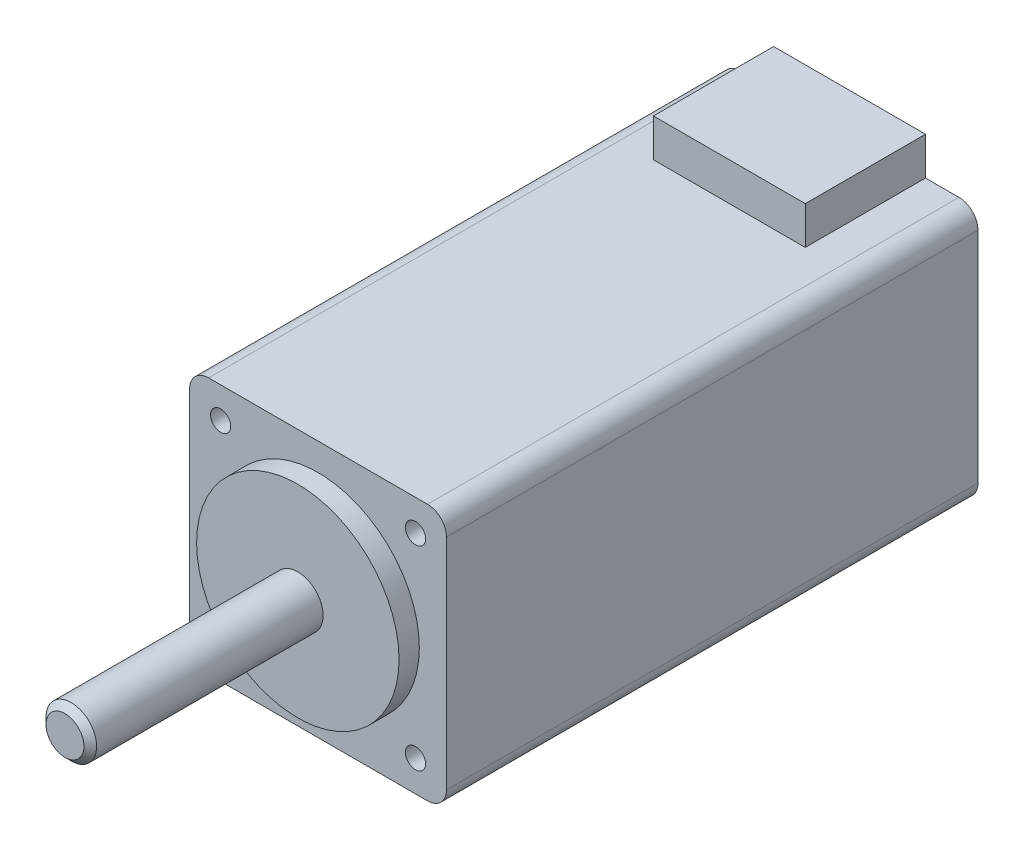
SolidWorks part; units mm, degrees
ref_plane "前视基准面" through (0, 0, 0) normal (0, 0, 1) x (1, 0, 0)
ref_plane "上视基准面" through (0, 0, 0) normal (0, 1, 0) x (1, 0, 0)
ref_plane "右视基准面" through (0, 0, 0) normal (1, 0, 0) x (0, 0, -1)
sketch "草图1" plane through (0, 0, 0) normal (0, 0, 1) x (1, 0, 0)
  circle A0 centre (0, 0) radius 8
extrude "凸台-拉伸1" add sketch "草图1" against normal blind 1.6
sketch "草图2" plane through (0, 0, 0) normal (0, 0, 1) x (1, 0, 0)
  circle A0 centre (0, 0) radius 2
extrude "凸台-拉伸2" add sketch "草图2" along normal blind 18.4
chamfer "倒角1" distance 0.5 angle 45 1 edges at (2, 0, 18.4)
sketch "草图4" plane through (0, 0, -1.6) normal (0, 0, -1) x (-1, 0, 0)
  line L1 (0, 10.15) -> (8.65, 10.15)
  line L2 (10.15, 8.65) -> (10.15, -8.65)
  line L3 (8.65, -10.15) -> (-8.65, -10.15)
  line L4 (-10.15, -8.65) -> (-10.15, 8.65)
  line L5 (-8.65, 10.15) -> (0, 10.15)
  arc A0 (-8.65, -10.15) -> (-10.15, -8.65) centre (-8.65, -8.65) cw
  arc A1 (10.15, -8.65) -> (8.65, -10.15) centre (8.65, -8.65) cw
  arc A2 (8.65, 10.15) -> (10.15, 8.65) centre (8.65, 8.65) cw
  arc A3 (-10.15, 8.65) -> (-8.65, 10.15) centre (-8.65, 8.65) cw
  dimension "D1" = 1.5
extrude "凸台-拉伸3" add sketch "草图4" along normal blind 42
sketch "草图6" plane through (0, 0, -43.6) normal (0, 0, -1) x (-1, 0, 0)
  line L0 (0, 10.15) -> (6, 10.15)
  line L1 (8.65, 10.15) -> (-8.65, 10.15) construction
  line L2 (6, 10.15) -> (6, 13.15)
  line L3 (6, 13.15) -> (-6, 13.15)
  line L4 (-6, 13.15) -> (-6, 10.15)
  line L5 (-6, 10.15) -> (0, 10.15)
extrude "凸台-拉伸4" add sketch "草图6" against normal blind 9.5
sketch "草图7" plane through (0, 0, -1.6) normal (0, 0, 1) x (1, 0, 0)
  point P8 (-7.7, 7.7)
  point P9 (7.7, 7.7)
  point P10 (7.7, -7.7)
  point P11 (-7.7, -7.7)
hole_wizard "M2 螺纹孔1" positions "草图9" profile "草图8" tap size "M2" standard "GB"
sketch "草图9" plane through (0, 0, -1.6) normal (0, 0, 1) x (1, 0, 0)
  point P0 (-7.7, 7.7)
  point P3 (7.7, 7.7)
  point P6 (7.7, -7.7)
  point P9 (-7.7, -7.7)
sketch "草图8" plane through (-7.7, 7.7, -1.6) normal (1, 0, 0) x (0, -1, 0)
  line L0 (0, 0) -> (0, 5.9807)
  line L1 (0, 5.9807) -> (0.8, 5.5)
  line L2 (0.8, 5.5) -> (0.8, 0)
  line L5 (0.8, 0) -> (0, 0)
  line L10 (0, 5.9807) -> (-0.8, 5.5) construction
  line L11 (0, -6.35) -> (0, 107.95) construction
  dimension "螺纹孔钻头直径" = 1.6
  dimension "螺纹孔钻头深度" = 5.5
  dimension "导头角度" = 118
